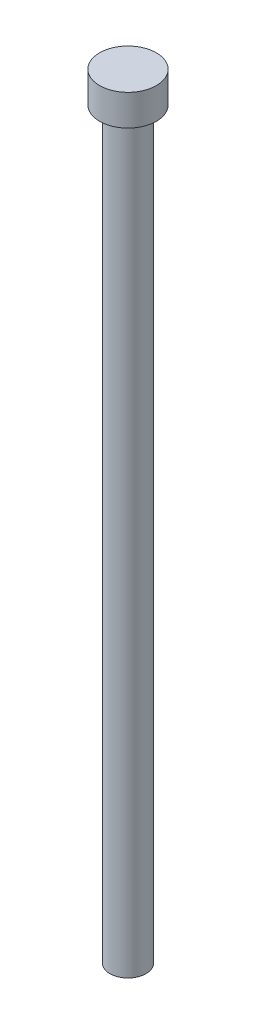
SolidWorks part; units mm, degrees
ref_plane "Front Plane" through (0, 0, 0) normal (0, 0, 1) x (1, 0, 0)
ref_plane "Top Plane" through (0, 0, 0) normal (0, 1, 0) x (1, 0, 0)
ref_plane "Right Plane" through (0, 0, 0) normal (1, 0, 0) x (0, 0, -1)
sketch "HeadDia" plane through (0, 0, 0) normal (0, 1, 0) x (1, 0, 0)
  circle A0 centre (0, 0) radius 5.5
  dimension "D1" = 11
extrude "HeadThickness" add sketch "HeadDia" against normal blind 6
sketch "PinDia" plane through (0, 0, 0) normal (0, -1, 0) x (1, 0, 0)
  circle A0 centre (0, 0) radius 3.5
  dimension "D1" = 7
extrude "Length" add sketch "PinDia" along normal blind 150
fillet "Radius" radius 0.3 1 edges at (0, -6, 3.5)
